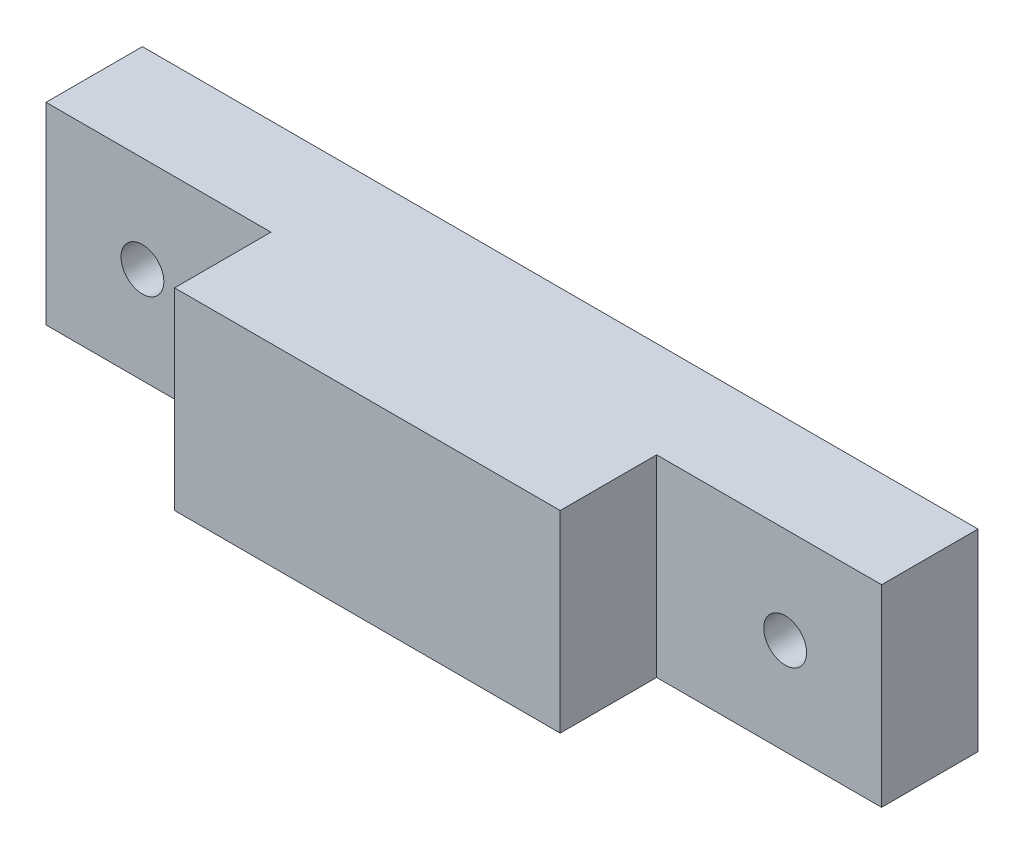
SolidWorks part; units mm, degrees
ref_plane "Plan de face" through (0, 0, 0) normal (0, 0, 1) x (1, 0, 0)
ref_plane "Plan de dessus" through (0, 0, 0) normal (0, 1, 0) x (1, 0, 0)
ref_plane "Plan de droite" through (0, 0, 0) normal (1, 0, 0) x (0, 0, -1)
sketch "Esquisse1" plane through (0, 0, 0) normal (0, 0, 1) x (1, 0, 0)
  line L1 (0, 0) -> (39, 0)
  line L2 (0, 0) -> (0, 9)
  line L3 (0, 9) -> (39, 9)
  line L4 (39, 0) -> (39, 9)
  dimension "D1" = 39
  dimension "D2" = 9
extrude "Extrusion1" add sketch "Esquisse1" along normal blind 9
sketch "Esquisse2" plane through (0, 0, 9) normal (0, 0, 1) x (1, 0, 0)
  line L0 (39, 9) -> (0, 9) construction
  line L1 (0, 0) -> (10.5, 0)
  line L2 (0, 0) -> (0, 9)
  line L3 (0, 9) -> (10.5, 9)
  line L4 (10.5, 0) -> (10.5, 9)
  line L6 (39, 0) -> (28.5, 0)
  line L7 (39, 0) -> (39, 9)
  line L8 (39, 9) -> (28.5, 9)
  line L9 (28.5, 0) -> (28.5, 9)
  dimension "D1" = 10.5
  dimension "D2" = 10.5
extrude "Enlèv. mat.-Extru.1" cut sketch "Esquisse2" against normal blind 4.5
sketch "Esquisse3" plane through (0, 0, 4.5) normal (0, 0, 1) x (1, 0, 0)
  line L0 (0, 9) -> (0, 0) construction
  line L1 (39, 0) -> (39, 9) construction
  line L2 (10.5, 9) -> (0, 9) construction
  line L3 (39, 9) -> (28.5, 9) construction
  circle A0 centre (4.5, 4.5) radius 1
  circle A1 centre (34.5, 4.5) radius 1
  point P6 (39, 4.5)
  point P11 (33.75, 9)
  dimension "D1" = 2
  dimension "D2" = 2
  dimension "D3" = 4.5
  dimension "D4" = 4.5
  dimension "D5" = 4.5
  dimension "D6" = 4.5
extrude "Enlèv. mat.-Extru.2" cut sketch "Esquisse3" against normal blind 4.5
